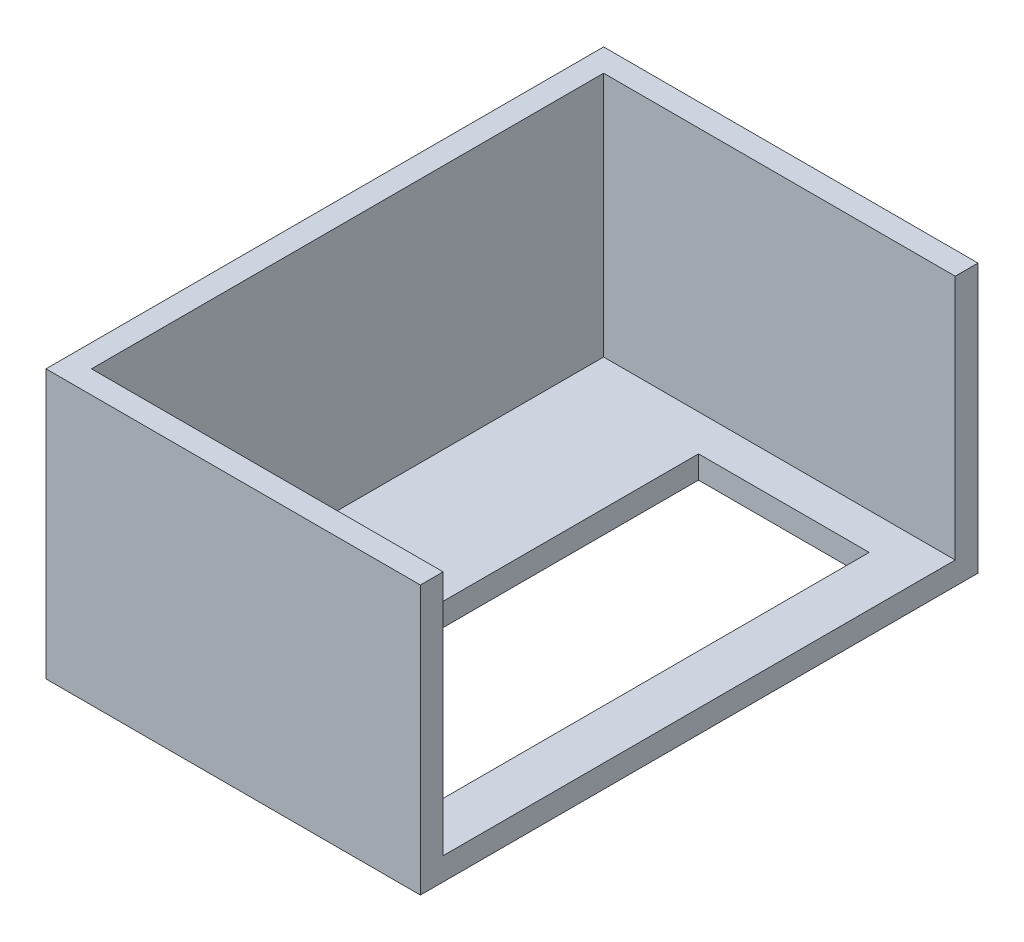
SolidWorks part; units mm, degrees
ref_plane "Front Plane" through (0, 0, 0) normal (0, 0, 1) x (1, 0, 0)
ref_plane "Top Plane" through (0, 0, 0) normal (0, 1, 0) x (1, 0, 0)
ref_plane "Right Plane" through (0, 0, 0) normal (1, 0, 0) x (0, 0, -1)
sketch "Sketch4" plane through (0, 0, 0) normal (0, 1, 0) x (1, 0, 0)
  line L2 (-4688.3352, 3407.7085) -> (-4671.8852, 3407.7085)
  line L3 (-4688.3352, 3407.7085) -> (-4688.3352, 3383.2085)
  line L4 (-4688.3352, 3383.2085) -> (-4671.8852, 3383.2085)
  line L5 (-4671.8852, 3407.7085) -> (-4671.8852, 3383.2085)
  dimension "D1" = 24.5
  dimension "D2" = 16.45
extrude "Boss-Extrude1" add sketch "Sketch4" along normal blind 1
sketch "Sketch5" plane through (0, 1, 0) normal (0, 1, 0) x (1, 0, 0)
  line L0 (-4671.8852, 3383.2085) -> (-4671.8852, 3407.7085) construction
  line L2 (-4688.3352, 3407.7085) -> (-4671.8852, 3407.7085)
  line L3 (-4688.3352, 3407.7085) -> (-4688.3352, 3406.7085)
  line L4 (-4688.3352, 3406.7085) -> (-4671.8852, 3406.7085)
  line L5 (-4671.8852, 3407.7085) -> (-4671.8852, 3406.7085)
  line L6 (-4688.3352, 3383.2085) -> (-4671.8852, 3383.2085)
  line L7 (-4688.3352, 3383.2085) -> (-4688.3352, 3384.2085)
  line L8 (-4688.3352, 3384.2085) -> (-4671.8852, 3384.2085)
  line L9 (-4671.8852, 3383.2085) -> (-4671.8852, 3384.2085)
  dimension "D1" = 1
  dimension "D2" = 1
extrude "Boss-Extrude2" add sketch "Sketch5" along normal blind 10.8
sketch "Sketch6" plane through (0, 1, 0) normal (0, 1, 0) x (1, 0, 0)
  line L0 (-4671.8852, 3384.2085) -> (-4671.8852, 3406.7085) construction
  line L1 (-4681.5652, 3405.1085) -> (-4674.0652, 3405.1085)
  line L2 (-4681.5652, 3405.1085) -> (-4681.5652, 3385.8085)
  line L3 (-4681.5652, 3385.8085) -> (-4674.0652, 3385.8085)
  line L4 (-4674.0652, 3405.1085) -> (-4674.0652, 3385.8085)
  line L6 (-4688.3352, 3406.7085) -> (-4671.8852, 3406.7085) construction
  dimension "D1" = 2.18
  dimension "D2" = 7.5
  dimension "D3" = 19.3
  dimension "D4" = 1.6
extrude "Cut-Extrude1" cut sketch "Sketch6" against normal through all
sketch "Sketch7" plane through (0, 1, 0) normal (0, 1, 0) x (1, 0, 0)
  line L0 (-4688.3352, 3406.7085) -> (-4671.8852, 3406.7085) construction
  line L1 (-4688.3352, 3384.2085) -> (-4687.3352, 3384.2085)
  line L2 (-4688.3352, 3384.2085) -> (-4688.3352, 3406.7085)
  line L3 (-4688.3352, 3406.7085) -> (-4687.3352, 3406.7085)
  line L4 (-4687.3352, 3384.2085) -> (-4687.3352, 3406.7085)
  dimension "D1" = 1
extrude "Boss-Extrude3" add sketch "Sketch7" along normal blind 10.8
